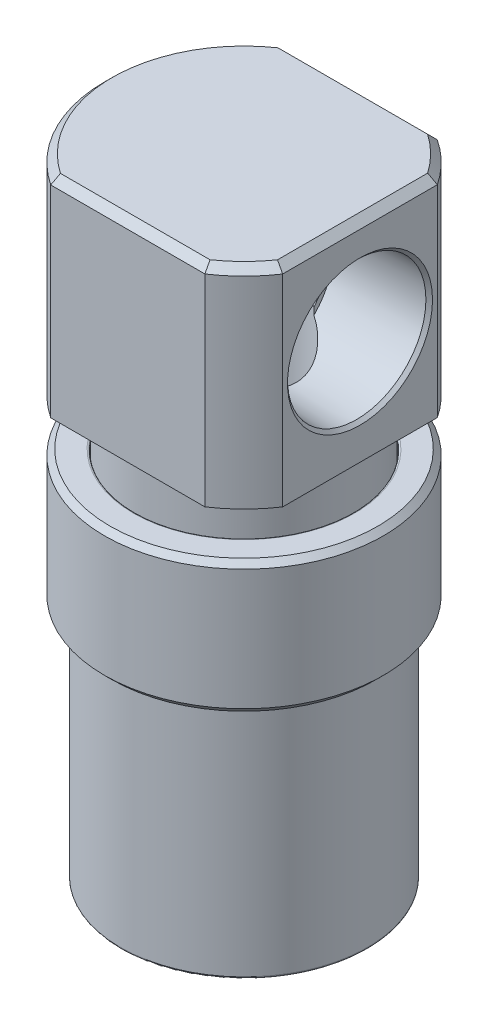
SolidWorks part; units mm, degrees
other "BODY_"
ref_plane "Front Plane" through (0, 0, 0) normal (0, 0, 1) x (1, 0, 0)
ref_plane "Top Plane" through (0, 0, 0) normal (0, 1, 0) x (1, 0, 0)
ref_plane "Right Plane" through (0, 0, 0) normal (1, 0, 0) x (0, 0, -1)
imported_body "SC200S"
imported_body "SLEEVE"
imported_body "BODY"
other "Move Face1" parameters "D1"=1.5875
sketch "Sketch1" plane through (5.1181, 0, 0) normal (1, 0, 0) x (0, 0, -1)
  circle A0 centre (0, 34.544) radius 5.08
extrude "Boss-Extrude1" add sketch "Sketch1" along normal up to surface (0.2684 mm away)
sketch "Sketch2" plane through (5.1181, 0, 0) normal (-1, 0, 0) x (0, 0, 1)
  line L1 (4.6156, 29.9175) -> (-4.6156, 29.9175)
  line L2 (4.6156, 29.9175) -> (4.6156, 39.1705)
  line L3 (4.6156, 39.1705) -> (-4.6156, 39.1705)
  line L4 (-4.6156, 29.9175) -> (-4.6156, 39.1705)
  line L5 (4.6156, 29.9175) -> (-4.6156, 39.1705) construction
  line L6 (4.6156, 39.1705) -> (-4.6156, 29.9175) construction
  point P0 (0, 34.544)
extrude "Boss-Extrude2" add sketch "Sketch2" along normal up to surface (10.9074 mm away)
sketch "Sketch3" plane through (0, 42.8625, 0) normal (0, 1, 0) x (1, 0, 0)
  line L0 (-13.084, 0) -> (14.7499, 0) construction
  line L1 (-5.2651, -7.9375) -> (5.2651, -7.9375)
  line L3 (-5.2651, 7.9375) -> (5.2651, 7.9375)
  line L4 (7.9248, -5.2842) -> (7.9248, 5.2842)
  line L5 (-6.5688, -6.8976) -> (6.5688, 6.8976) construction
  line L6 (-6.5688, 6.8976) -> (6.5688, -6.8976) construction
  arc A0 (7.9248, 5.2842) -> (5.2651, 7.9375) centre (0, 0) ccw
  arc A1 (5.2651, -7.9375) -> (7.9248, -5.2842) centre (0, 0) ccw
  arc A2 (-5.2651, 7.9375) -> (-5.2651, -7.9375) centre (0, 0) ccw
  dimension "D2" = 9.525
  dimension "D1" = 15.875
  dimension "D3" = 7.9248
extrude "Boss-Extrude3" add sketch "Sketch3" against normal blind 14.2875
hole_wizard "1/8 NPT Tapped Hole1" positions "Sketch4" profile "Sketch5" size "1/8" standard "ANSI Inch"
sketch "Sketch4" plane through (7.9248, 0, 0) normal (1, 0, 0) x (0, 0, -1)
  line L0 (-5.2842, 42.8625) -> (5.2842, 42.8625) construction
  point P0 (0, 35.7188)
  dimension "D1" = 7.1437
sketch "Sketch5" plane through (7.9248, 35.7188, 0) normal (0, 1, 0) x (0, 0, -1)
  line L0 (0, 0) -> (0, 13.9635)
  line L1 (4.2164, 11.43) -> (0, 13.9635)
  line L2 (-4.2164, 11.43) -> (0, 13.9635) construction
  line L3 (4.2164, 11.43) -> (4.2164, 6.35)
  line L4 (4.2164, 6.35) -> (4.5442, 6.35)
  line L5 (4.5442, 6.35) -> (4.7275, 0.2255)
  line L6 (4.7275, 0.2255) -> (4.953, 0)
  line L7 (4.953, 0) -> (0, 0)
  line L8 (0, -6.35) -> (0, 107.95) construction
  line L9 (-4.7275, 0.2255) -> (-4.953, 0) construction
  line L11 (-4.2164, 6.35) -> (-4.5442, 6.35) construction
  line L12 (-4.5442, 6.35) -> (-4.7275, 0.2255) construction
  dimension "Tap Drill Dia." = 8.4328
  dimension "Tap Drill Depth" = 11.43
  dimension "Thread Dia." = 9.4551
  dimension "Thread Angle" = 3.43
  dimension "Thread Depth" = 6.35
  dimension "C'Sink Dia." = 9.906
  dimension "C'Sink Angle" = 90
  dimension "Drill Angle" = 118
sketch "Sketch6" plane through (0, 28.575, 0) normal (0, -1, 0) x (1, 0, 0)
  circle A1 centre (0, 0) radius 3.5687
  circle A2 centre (0, 0) radius 3.5687
  dimension "D1" = 0
extrude "Cut-Extrude1" cut sketch "Sketch6" against normal blind 6.35
chamfer "Chamfer1" distance 0.508 angle 45 6 edges at (0, 42.8625, 7.9375) (-9.525, 42.8625, 0) (0, 42.8625, -7.9375) (6.7271, 42.8625, -6.7433) (7.9248, 42.8625, 0) (6.7271, 42.8625, 6.7433)
